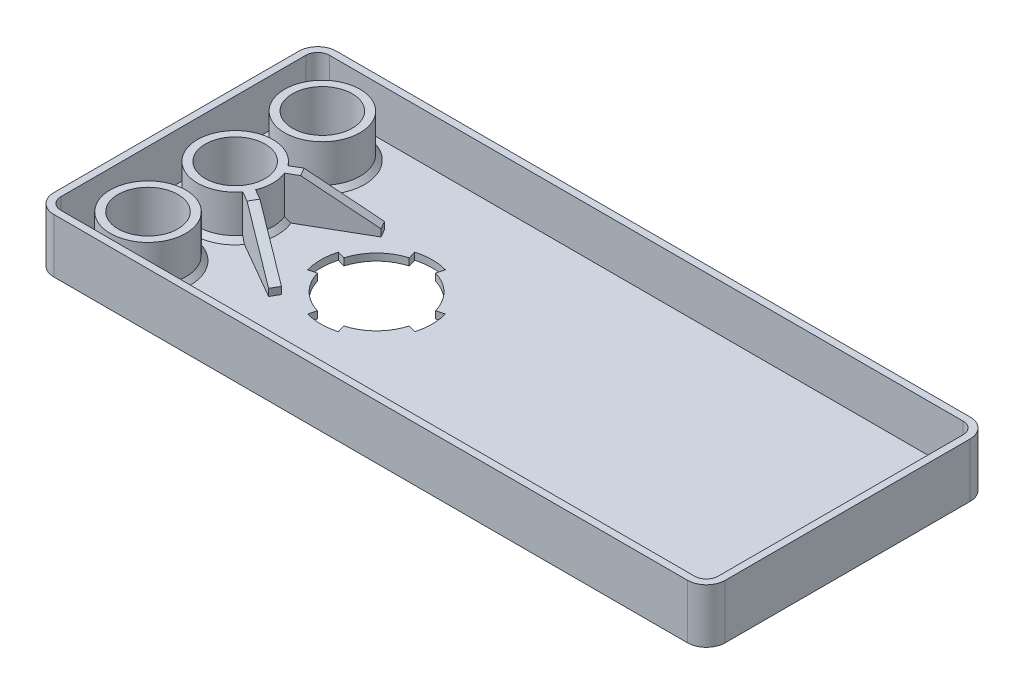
SolidWorks part; units mm, degrees
ref_plane "Front Plane" through (0, 0, 0) normal (0, 0, 1) x (1, 0, 0)
ref_plane "Top Plane" through (0, 0, 0) normal (0, 1, 0) x (1, 0, 0)
ref_plane "Right Plane" through (0, 0, 0) normal (1, 0, 0) x (0, 0, -1)
sketch "Esquisse1" plane through (0, 0, 0) normal (0, 1, 0) x (1, 0, 0)
  line L1 (-134.5, 60) -> (134.5, 60)
  line L2 (-142.5, 52) -> (-142.5, -52)
  line L3 (-134.5, -60) -> (134.5, -60)
  line L4 (142.5, 52) -> (142.5, -52)
  arc A1 (134.5, 60) -> (142.5, 52) centre (134.5, 52) cw
  arc A2 (142.5, -52) -> (134.5, -60) centre (134.5, -52) cw
  arc A3 (-134.5, -60) -> (-142.5, -52) centre (-134.5, -52) cw
  arc A4 (-142.5, 52) -> (-134.5, 60) centre (-134.5, 52) cw
  point P1 (0, 60)
  point P2 (-142.5, 0)
  dimension "D2" = 8
  dimension "D4" = 285
  dimension "D5" = 120
extrude "Boss.-Extru.1" add sketch "Esquisse1" along normal blind 23
shell "Coque1" thickness 3
sketch "Esquisse4" plane through (0, 3, -3) normal (0, -1, 0) x (1, 0, 0)
  line L0 (-142.5, -49) -> (-142.5, 55) construction
  circle A0 centre (-117.5, 3) radius 16
  circle A5 centre (-117.5, 40) radius 16
  circle A6 centre (-117.5, -34) radius 16
extrude "Boss.-Extru.3" add sketch "Esquisse4" against normal blind 18
sketch "Esquisse5" plane through (0, 21, 0) normal (0, 1, 0) x (1, 0, 0)
  circle A0 centre (-117.5, 37) radius 12.7
  circle A1 centre (-117.5, 0) radius 12.7
  circle A2 centre (-117.5, -37) radius 12.7
  circle A3 centre (-117.5, 37) radius 16 construction
  circle A4 centre (-117.5, 0) radius 16 construction
  circle A5 centre (-117.5, -37) radius 16 construction
  circle A6 centre (-57.5, 0) radius 20.25
  point P14 (0, 0)
  point P15 (0, 0)
  point P16 (0, 0)
  dimension "D1" = 25.4
  dimension "D2" = 40.5
  dimension "D3" = 60
extrude "Enlèv. mat.-Extru.2" cut sketch "Esquisse5" against normal through all
chamfer "Chanfrein1" distance 2 angle 45 3 edges at (-117.5, 3, 21) (-117.5, 3, -53) (-117.5, 3, -16)
ref_axis "AxeTrou" through (-57.5, 0, 0) along (0, 1, 0)
sketch "Esquisse7" plane through (0, 3, 0) normal (0, 1, 0) x (1, 0, 0)
  line L0 (-80.2338, 6.5188) -> (-57.5, 0)
  line L1 (-57.5, 0) -> (-80.2338, -6.5188)
  arc A0 (-80.2338, 6.5188) -> (-80.2338, -6.5188) centre (-57.5, 0) ccw
  circle A1 centre (-57.5, 0) radius 20.25 construction
  point P5 (-81.15, 0)
  dimension "D1" = 3.4
  dimension "D2" = 32
extrude "Enlèv. mat.-Extru.3" cut sketch "Esquisse7" against normal through all
pattern_circular "Répétition circulaire1" count 4 over 360 about axis through (-57.5, 0, 0) along (0, 1, 0) of "Enlèv. mat.-Extru.3"
sketch "Esquisse8" plane through (0, 3, 0) normal (0, 1, 0) x (1, 0, 0)
  line L0 (-104.6995, -9.5993) -> (-78.7187, -24.5993)
  line L1 (-117.5, 0) -> (-90.2538, 0) construction
  line L2 (-78.7187, -24.5993) -> (-76.7187, -21.1352)
  line L3 (-102.7185, -6.1242) -> (-76.7187, -21.1352)
  line L4 (-78.7187, 24.5993) -> (-76.7187, 21.1352)
  line L5 (-104.6995, 9.5993) -> (-78.7187, 24.5993)
  line L6 (-102.7185, 6.1242) -> (-76.7187, 21.1352)
  circle A0 centre (-117.5, 0) radius 16 construction
  arc A3 (-104.6995, -9.5993) -> (-102.7185, -6.1242) centre (-117.5, 0) ccw
  circle A5 centre (-117.5, 0) radius 16 construction
  arc A6 (-104.6995, 9.5993) -> (-102.7185, 6.1242) centre (-117.5, 0) cw
  dimension "D1" = 30
  dimension "D2" = 4
  dimension "D3" = 30
extrude "Boss.-Extru.5" add sketch "Esquisse8" along normal up to surface (18 mm away)
chamfer "Chanfrein4" distance 25 distance2 15 2 edges at (-77.7187, 21, -22.8673) (-77.7187, 21, 22.8673)
equation "\"D6@Esquisse4\"=\"D7@Esquisse4\""
